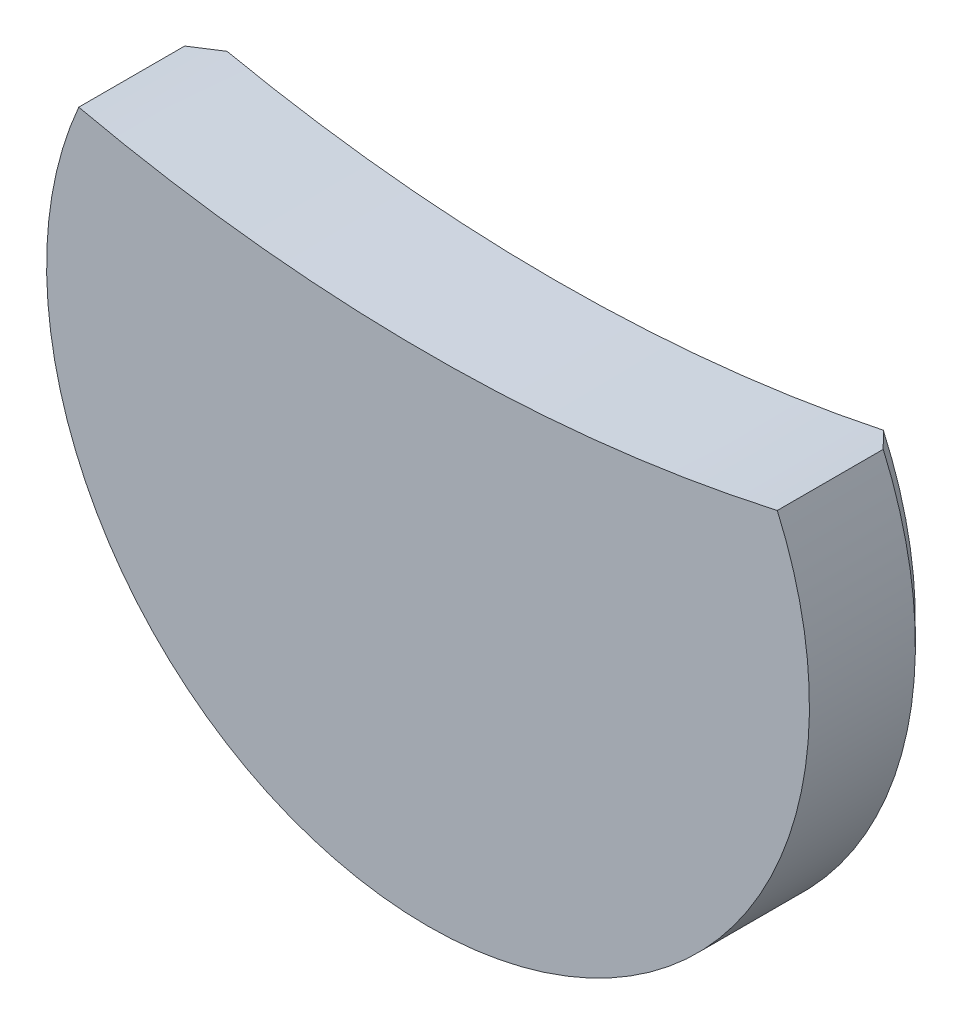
SolidWorks part; units mm, degrees
ref_plane "Front Plane" through (0, 0, 0) normal (0, 0, 1) x (1, 0, 0)
ref_plane "Top Plane" through (0, 0, 0) normal (0, 1, 0) x (1, 0, 0)
ref_plane "Right Plane" through (0, 0, 0) normal (1, 0, 0) x (0, 0, -1)
sketch "Sketch2" plane through (0, 0, 0) normal (0, 0, 1) x (1, 0, 0)
  arc A0 (-8.2413, 3.6168) -> (8.2413, 3.6168) centre (0, 0) ccw
  arc A1 (-8.2413, 3.6168) -> (8.2413, 3.6168) centre (0, 40.2) ccw
extrude "Boss-Extrude1" add sketch "Sketch2" along normal blind 3
chamfer "Chamfer1" distance 0.5 angle 45 1 edges at (0, -9, 0)
